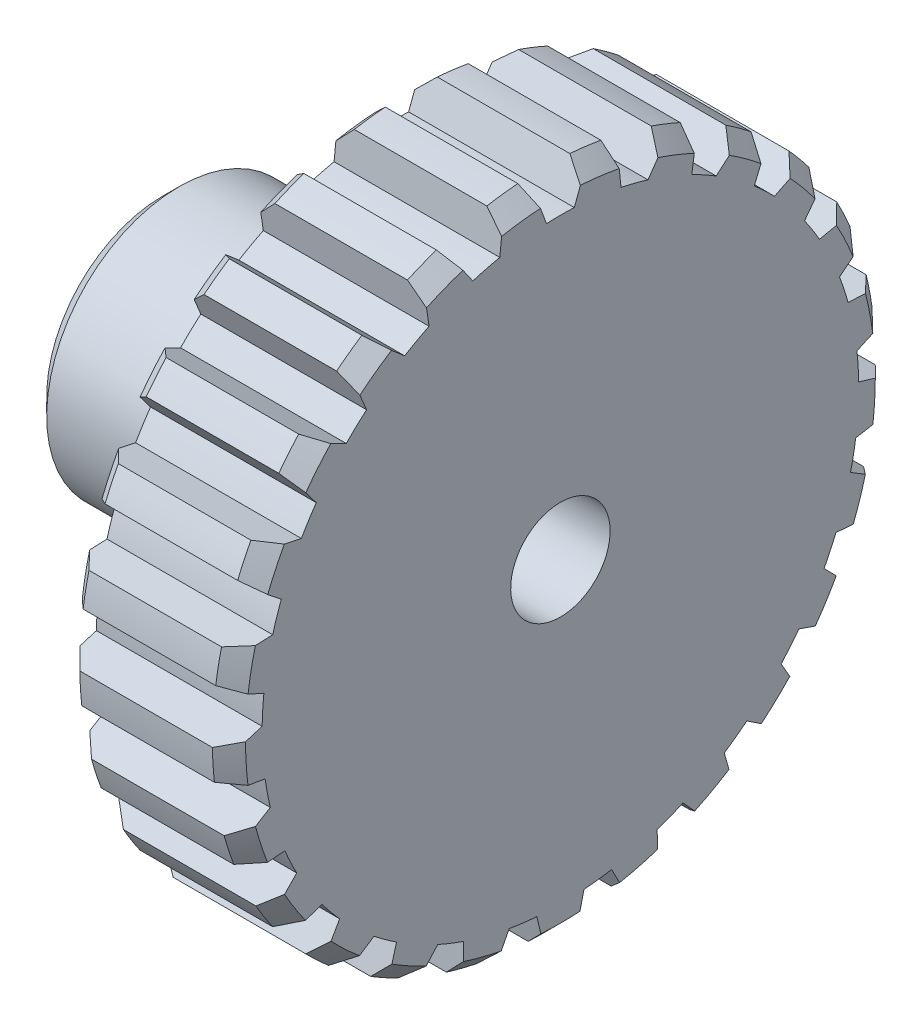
SolidWorks part; units mm, degrees
ref_plane "Front" through (0, 0, 0) normal (0, 0, 1) x (1, 0, 0)
ref_plane "Top" through (0, 0, 0) normal (0, 1, 0) x (1, 0, 0)
ref_plane "Right" through (0, 0, 0) normal (1, 0, 0) x (0, 0, -1)
sketch "Sketch1" plane through (0, 0, 0) normal (0, 0, 1) x (1, 0, 0)
  line L0 (0, 0) -> (-12, 0)
  line L1 (-12, 1.5) -> (-12, 4)
  line L2 (-12, 4) -> (-5, 4)
  line L3 (-5, 4) -> (-5, 10)
  line L4 (-5, 10) -> (0, 10)
  line L5 (0, 10) -> (0, 1.5)
  line L6 (0, 1.5) -> (-12, 1.5)
  dimension "D1" = 10
  dimension "D2" = 4
  dimension "D3" = 12
  dimension "D4" = 7
  dimension "D5" = 1.5
revolve "Revolve1" add sketch "Sketch1" angle 360 about L0
sketch "Sketch3" plane through (0, 0, 0) normal (1, 0, 0) x (0, 0, -1)
  line L0 (-0.785, 9.9691) -> (-0.42, 8.9902)
  line L1 (0.785, 9.9691) -> (0.785, 10.7794)
  line L2 (1.9204, 10.636) -> (1.7189, 9.8512)
  line L3 (-0.785, 10.7794) -> (-0.785, 9.9691)
  line L4 (1.7189, 9.8512) -> (1.829, 8.8122)
  line L5 (0.42, 8.9902) -> (0.785, 9.9691)
  line L6 (2.6426, 8.6033) -> (3.2396, 9.4607)
  line L7 (3.2396, 9.4607) -> (3.4411, 10.2455)
  line L8 (4.5051, 9.8243) -> (4.1148, 9.1142)
  line L9 (4.1148, 9.1142) -> (3.963, 8.0805)
  line L10 (4.6991, 7.6758) -> (5.4906, 8.3578)
  line L11 (5.4906, 8.3578) -> (5.8809, 9.0679)
  line L12 (6.8068, 8.3952) -> (6.2521, 7.8046)
  line L13 (6.2521, 7.8046) -> (5.848, 6.8411)
  line L14 (6.4604, 6.2661) -> (7.3966, 6.7298)
  line L15 (7.3966, 6.7298) -> (7.9513, 7.3205)
  line L16 (8.6807, 6.4387) -> (7.9966, 6.0045)
  line L17 (7.9966, 6.0045) -> (7.3656, 5.1718)
  line L18 (7.8157, 4.4626) -> (8.8378, 4.6789)
  line L19 (8.8378, 4.6789) -> (9.522, 5.1131)
  line L20 (10.0093, 4.0776) -> (9.2386, 3.8272)
  line L21 (9.2386, 3.8272) -> (8.4204, 3.1776)
  line L22 (8.68, 2.3787) -> (9.7238, 2.3341)
  line L23 (9.7238, 2.3341) -> (10.4944, 2.5844)
  line L24 (10.7089, 1.4603) -> (9.9002, 1.4094)
  line L25 (9.9002, 1.4094) -> (8.9461, 0.9837)
  line L26 (8.9988, 0.1453) -> (9.9988, -0.1575)
  line L27 (9.9988, -0.1575) -> (10.8074, -0.1066)
  line L28 (10.7356, -1.2488) -> (9.9397, -1.0969)
  line L29 (9.9397, -1.0969) -> (8.9097, -1.272)
  line L30 (8.7523, -2.0972) -> (9.6455, -2.6391)
  line L31 (9.6455, -2.6391) -> (10.4414, -2.791)
  line L32 (10.0878, -3.8794) -> (9.3546, -3.5344)
  line L33 (9.3546, -3.5344) -> (8.3134, -3.4478)
  line L34 (7.9557, -4.2079) -> (8.6861, -4.9549)
  line L35 (8.6861, -4.9549) -> (9.4193, -5.2999)
  line L36 (8.8061, -6.2662) -> (8.1817, -5.7497)
  line L37 (8.1817, -5.7497) -> (7.1948, -5.407)
  line L38 (6.6593, -6.0542) -> (7.181, -6.9594)
  line L39 (7.181, -6.9594) -> (7.8053, -7.4759)
  line L40 (6.9711, -8.2593) -> (6.4948, -7.6038)
  line L41 (6.4948, -7.6038) -> (5.6241, -7.0264)
  line L42 (4.9445, -7.5201) -> (5.2246, -8.5266)
  line L43 (5.2246, -8.5266) -> (5.7009, -9.1821)
  line L44 (4.698, -9.7335) -> (4.3998, -8.9801)
  line L45 (4.3998, -8.9801) -> (3.7, -8.2043)
  line L46 (2.919, -8.5135) -> (2.94, -9.5581)
  line L47 (2.94, -9.5581) -> (3.2383, -10.3114)
  line L48 (2.1298, -10.596) -> (2.0283, -9.7921)
  line L49 (2.0283, -9.7921) -> (1.5435, -8.8667)
  line L50 (0.7101, -8.9719) -> (0.4707, -9.9889)
  line L51 (0.4707, -9.9889) -> (0.5722, -10.7928)
  line L52 (-0.5722, -10.7928) -> (-0.4707, -9.9889)
  line L53 (-0.4707, -9.9889) -> (-0.7101, -8.9719)
  line L54 (-1.5435, -8.8667) -> (-2.0283, -9.7921)
  line L55 (-2.0283, -9.7921) -> (-2.1298, -10.596)
  line L56 (-3.2383, -10.3114) -> (-2.94, -9.5581)
  line L57 (-2.94, -9.5581) -> (-2.919, -8.5135)
  line L58 (-3.7, -8.2043) -> (-4.3998, -8.9801)
  line L59 (-4.3998, -8.9801) -> (-4.698, -9.7335)
  line L60 (-5.7009, -9.1821) -> (-5.2246, -8.5266)
  line L61 (-5.2246, -8.5266) -> (-4.9445, -7.5201)
  line L62 (-5.6241, -7.0264) -> (-6.4948, -7.6038)
  line L63 (-6.4948, -7.6038) -> (-6.9711, -8.2593)
  line L64 (-7.8053, -7.4759) -> (-7.181, -6.9594)
  line L65 (-7.181, -6.9594) -> (-6.6593, -6.0542)
  line L66 (-7.1948, -5.407) -> (-8.1817, -5.7497)
  line L67 (-8.1817, -5.7497) -> (-8.8061, -6.2662)
  line L68 (-9.4193, -5.2999) -> (-8.6861, -4.9549)
  line L69 (-8.6861, -4.9549) -> (-7.9557, -4.2079)
  line L70 (-8.3134, -3.4478) -> (-9.3546, -3.5344)
  line L71 (-9.3546, -3.5344) -> (-10.0878, -3.8794)
  line L72 (-10.4414, -2.791) -> (-9.6455, -2.6391)
  line L73 (-9.6455, -2.6391) -> (-8.7523, -2.0972)
  line L74 (-8.9097, -1.272) -> (-9.9397, -1.0969)
  line L75 (-9.9397, -1.0969) -> (-10.7356, -1.2488)
  line L76 (-10.8074, -0.1066) -> (-9.9988, -0.1575)
  line L77 (-9.9988, -0.1575) -> (-8.9988, 0.1453)
  line L78 (-8.9461, 0.9837) -> (-9.9002, 1.4094)
  line L79 (-9.9002, 1.4094) -> (-10.7089, 1.4603)
  line L80 (-10.4944, 2.5844) -> (-9.7238, 2.3341)
  line L81 (-9.7238, 2.3341) -> (-8.68, 2.3787)
  line L82 (-8.4204, 3.1776) -> (-9.2386, 3.8272)
  line L83 (-9.2386, 3.8272) -> (-10.0093, 4.0776)
  line L84 (-9.522, 5.1131) -> (-8.8378, 4.6789)
  line L85 (-8.8378, 4.6789) -> (-7.8157, 4.4626)
  line L86 (-7.3656, 5.1718) -> (-7.9966, 6.0045)
  line L87 (-7.9966, 6.0045) -> (-8.6807, 6.4387)
  line L88 (-7.9513, 7.3205) -> (-7.3966, 6.7298)
  line L89 (-7.3966, 6.7298) -> (-6.4604, 6.2661)
  line L90 (-5.848, 6.8411) -> (-6.2521, 7.8046)
  line L91 (-6.2521, 7.8046) -> (-6.8068, 8.3952)
  line L92 (-5.8809, 9.0679) -> (-5.4906, 8.3578)
  line L93 (-5.4906, 8.3578) -> (-4.6991, 7.6758)
  line L94 (-3.963, 8.0805) -> (-4.1148, 9.1142)
  line L95 (-4.1148, 9.1142) -> (-4.5051, 9.8243)
  line L96 (-3.4411, 10.2455) -> (-3.2396, 9.4607)
  line L97 (-3.2396, 9.4607) -> (-2.6426, 8.6033)
  line L98 (-1.829, 8.8122) -> (-1.7189, 9.8512)
  line L99 (-1.7189, 9.8512) -> (-1.9204, 10.636)
  arc A0 (3.4411, 10.2455) -> (1.9204, 10.636) centre (0, 0) ccw
  arc A1 (0.42, 8.9902) -> (-0.42, 8.9902) centre (0, 0) ccw
  arc A2 (0.785, 10.7794) -> (-0.785, 10.7794) centre (0, 0) ccw
  arc A3 (2.6426, 8.6033) -> (1.829, 8.8122) centre (0, 0) ccw
  arc A4 (5.8809, 9.0679) -> (4.5051, 9.8243) centre (0, 0) ccw
  arc A5 (4.6991, 7.6758) -> (3.963, 8.0805) centre (0, 0) ccw
  arc A6 (7.9513, 7.3205) -> (6.8068, 8.3952) centre (0, 0) ccw
  arc A7 (6.4604, 6.2661) -> (5.848, 6.8411) centre (0, 0) ccw
  arc A8 (9.522, 5.1131) -> (8.6807, 6.4387) centre (0, 0) ccw
  arc A9 (7.8157, 4.4626) -> (7.3656, 5.1718) centre (0, 0) ccw
  arc A10 (10.4944, 2.5844) -> (10.0093, 4.0776) centre (0, 0) ccw
  arc A11 (8.68, 2.3787) -> (8.4204, 3.1776) centre (0, 0) ccw
  arc A12 (10.8074, -0.1066) -> (10.7089, 1.4603) centre (0, 0) ccw
  arc A13 (8.9988, 0.1453) -> (8.9461, 0.9837) centre (0, 0) ccw
  arc A14 (10.4414, -2.791) -> (10.7356, -1.2488) centre (0, 0) ccw
  arc A15 (8.7523, -2.0972) -> (8.9097, -1.272) centre (0, 0) ccw
  arc A16 (9.4193, -5.2999) -> (10.0878, -3.8794) centre (0, 0) ccw
  arc A17 (7.9557, -4.2079) -> (8.3134, -3.4478) centre (0, 0) ccw
  arc A18 (7.8053, -7.4759) -> (8.8061, -6.2662) centre (0, 0) ccw
  arc A19 (6.6593, -6.0542) -> (7.1948, -5.407) centre (0, 0) ccw
  arc A20 (5.7009, -9.1821) -> (6.9711, -8.2593) centre (0, 0) ccw
  arc A21 (4.9445, -7.5201) -> (5.6241, -7.0264) centre (0, 0) ccw
  arc A22 (3.2383, -10.3114) -> (4.698, -9.7335) centre (0, 0) ccw
  arc A23 (2.919, -8.5135) -> (3.7, -8.2043) centre (0, 0) ccw
  arc A24 (0.5722, -10.7928) -> (2.1298, -10.596) centre (0, 0) ccw
  arc A25 (0.7101, -8.9719) -> (1.5435, -8.8667) centre (0, 0) ccw
  arc A26 (-2.1298, -10.596) -> (-0.5722, -10.7928) centre (0, 0) ccw
  arc A27 (-1.5435, -8.8667) -> (-0.7101, -8.9719) centre (0, 0) ccw
  arc A28 (-4.698, -9.7335) -> (-3.2383, -10.3114) centre (0, 0) ccw
  arc A29 (-3.7, -8.2043) -> (-2.919, -8.5135) centre (0, 0) ccw
  arc A30 (-6.9711, -8.2593) -> (-5.7009, -9.1821) centre (0, 0) ccw
  arc A31 (-5.6241, -7.0264) -> (-4.9445, -7.5201) centre (0, 0) ccw
  arc A32 (-8.8061, -6.2662) -> (-7.8053, -7.4759) centre (0, 0) ccw
  arc A33 (-7.1948, -5.407) -> (-6.6593, -6.0542) centre (0, 0) ccw
  arc A34 (-10.0878, -3.8794) -> (-9.4193, -5.2999) centre (0, 0) ccw
  arc A35 (-8.3134, -3.4478) -> (-7.9557, -4.2079) centre (0, 0) ccw
  arc A36 (-10.7356, -1.2488) -> (-10.4414, -2.791) centre (0, 0) ccw
  arc A37 (-8.9097, -1.272) -> (-8.7523, -2.0972) centre (0, 0) ccw
  arc A38 (-10.7089, 1.4603) -> (-10.8074, -0.1066) centre (0, 0) ccw
  arc A39 (-8.9461, 0.9837) -> (-8.9988, 0.1453) centre (0, 0) ccw
  arc A40 (-10.0093, 4.0776) -> (-10.4944, 2.5844) centre (0, 0) ccw
  arc A41 (-8.4204, 3.1776) -> (-8.68, 2.3787) centre (0, 0) ccw
  arc A42 (-8.6807, 6.4387) -> (-9.522, 5.1131) centre (0, 0) ccw
  arc A43 (-7.3656, 5.1718) -> (-7.8157, 4.4626) centre (0, 0) ccw
  arc A44 (-6.8068, 8.3952) -> (-7.9513, 7.3205) centre (0, 0) ccw
  arc A45 (-5.848, 6.8411) -> (-6.4604, 6.2661) centre (0, 0) ccw
  arc A46 (-4.5051, 9.8243) -> (-5.8809, 9.0679) centre (0, 0) ccw
  arc A47 (-3.963, 8.0805) -> (-4.6991, 7.6758) centre (0, 0) ccw
  arc A48 (-1.9204, 10.636) -> (-3.4411, 10.2455) centre (0, 0) ccw
  arc A49 (-1.829, 8.8122) -> (-2.6426, 8.6033) centre (0, 0) ccw
chamfer "Chamfer4" distance 0.5 angle 45 3 edges at (0, 10, 0) (-5, 10, 0) (-12, 4, 0)
extrude "Cut-Extrude2" cut sketch "Sketch3" against normal blind 10
